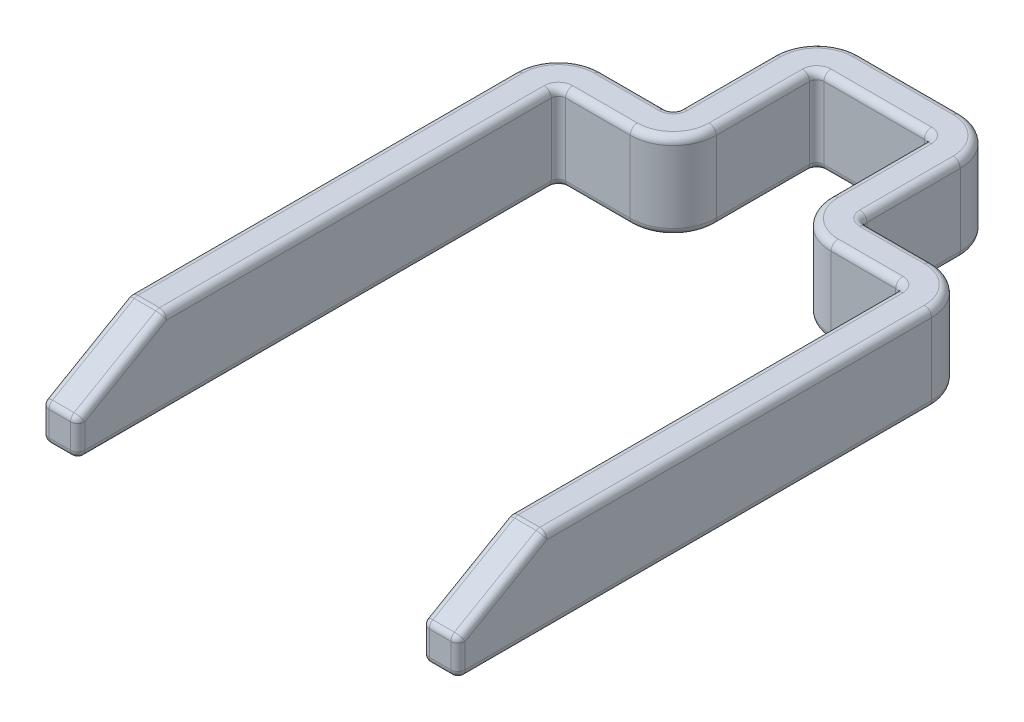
SolidWorks part; units mm, degrees
ref_plane "Plan1" through (0, 0, 0) normal (0, 0, 1) x (1, 0, 0)
ref_plane "Plan2" through (0, 0, 0) normal (0, 1, 0) x (1, 0, 0)
ref_plane "Plan3" through (0, 0, 0) normal (1, 0, 0) x (0, 0, -1)
sketch "Esquisse1" plane through (0, 0, 0) normal (0, 1, 0) x (1, 0, 0)
  line L0 (-12, -23.5) -> (-12, 9.5)
  line L1 (-11.5, 10) -> (-7, 10)
  line L2 (-4, 13) -> (-4, 19.5)
  line L3 (-3.5, 20) -> (3.5, 20)
  line L4 (4, 19.5) -> (4, 13)
  line L5 (7, 10) -> (11.5, 10)
  line L6 (12, 9.5) -> (12, -23.5)
  line L7 (0, 65.8022) -> (0, -65.8022) construction
  arc A0 (12, 9.5) -> (11.5, 10) centre (11.5, 9.5) ccw
  arc A1 (-12, 9.5) -> (-11.5, 10) centre (-11.5, 9.5) cw
  arc A2 (-3.5, 20) -> (-4, 19.5) centre (-3.5, 19.5) ccw
  arc A3 (4, 19.5) -> (3.5, 20) centre (3.5, 19.5) ccw
  arc A4 (4, 13) -> (7, 10) centre (7, 13) ccw
  arc A5 (-7, 10) -> (-4, 13) centre (-7, 13) ccw
  point P19 (4, 20)
  point P22 (4, 10)
  dimension "D6" = 0.5
  dimension "D7" = 3
  dimension "D1" = 8
  dimension "D2" = 24
  dimension "D3" = 10
  dimension "D4" = 33.5
  dimension "D5" = 10
extrude "Base-Extru.-Mince" add sketch "Esquisse1" along normal mid plane 6 thin
sketch "Esquisse2" plane through (0, 0, 0) normal (1, 0, 0) x (0, 0, -1)
  line L0 (-23.5, 3) -> (-23.5, -0.5)
  line L1 (-23.5, -0.5) -> (-17.4378, 3)
  line L2 (-17.4378, 3) -> (-23.5, 3)
  line L3 (9.5, 3) -> (-23.5, 3) construction
  line L4 (-23.5, 3) -> (-23.5, -3) construction
  line L5 (9.5, -3) -> (-23.5, -3) construction
  dimension "D1" = 30
  dimension "D2" = 2.5
extrude "Enlèv. mat.-Extru.1" cut sketch "Esquisse2" against normal through all and the other way through all
fillet "Congé1" radius 0.5
